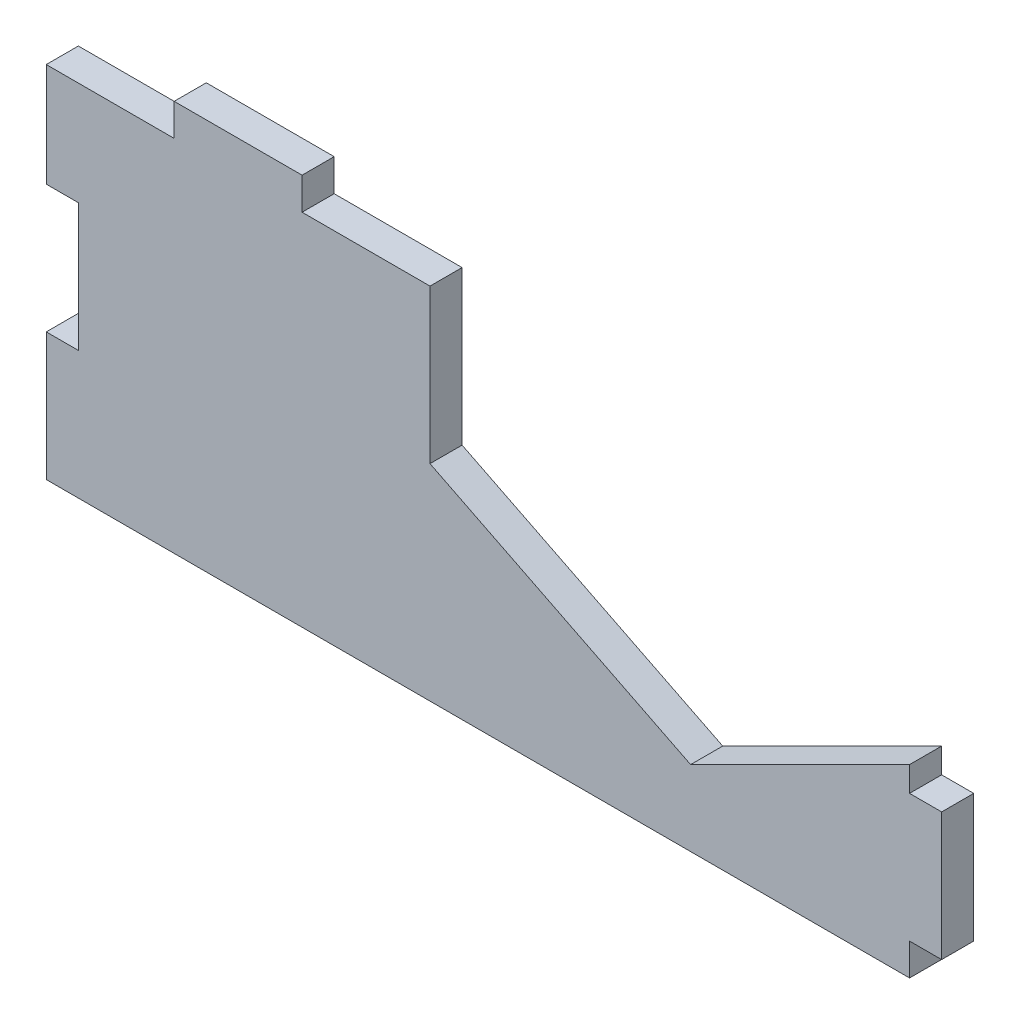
SolidWorks part; units mm, degrees
ref_plane "Front Plane" through (0, 0, 0) normal (0, 0, 1) x (1, 0, 0)
ref_plane "Top Plane" through (0, 0, 0) normal (0, 1, 0) x (1, 0, 0)
ref_plane "Right Plane" through (0, 0, 0) normal (1, 0, 0) x (0, 0, -1)
sketch "Sketch1" plane through (0, 0, 0) normal (0, 0, 1) x (1, 0, 0)
  line L0 (-209.4741, 246.21) -> (-363.745, 323.3454) construction
  line L1 (-79.8865, 311.0038) -> (-209.4741, 246.21) construction
  line L11 (-590.8865, 277.3229) -> (-590.8865, 201.6091)
  line L13 (-79.8865, 296.251) -> (-60.8865, 296.251)
  line L20 (-79.8865, 220.5372) -> (-60.8865, 220.5372)
  line L24 (-590.8865, 414.3653) -> (-515.1727, 414.3653)
  line L30 (-79.8865, 311.0038) -> (-79.8865, 296.251)
  line L32 (-590.8865, 277.3229) -> (-571.8865, 277.3229)
  line L35 (-515.1727, 433.3653) -> (-515.1727, 414.3653)
  line L37 (-590.8865, 353.0367) -> (-571.8865, 353.0367)
  line L38 (-79.8865, 220.5372) -> (-79.8865, 201.6091)
  line L39 (-60.8865, 296.251) -> (-60.8865, 220.5372)
  line L40 (-571.8865, 353.0367) -> (-571.8865, 277.3229)
  line L41 (-590.8865, 414.3653) -> (-590.8865, 353.0367)
  line L42 (-515.1727, 433.3653) -> (-439.4588, 433.3653)
  line L43 (-363.745, 323.3454) -> (-209.4741, 246.21)
  line L44 (-439.4588, 414.3653) -> (-363.745, 414.3653)
  line L45 (-363.745, 414.3653) -> (-363.745, 323.3454)
  line L46 (-439.4588, 433.3653) -> (-439.4588, 414.3653)
  line L47 (-590.8865, 201.6091) -> (-79.8865, 201.6091)
  line L48 (-209.4741, 246.21) -> (-79.8865, 311.0038)
  point P1 (-363.745, 323.3454)
  point P2 (-209.4741, 246.21)
  point P7 (-79.8865, 311.0038)
  dimension "D1" = 19
  dimension "D3" = 530
extrude "Boss-Extrude1" add sketch "Sketch1" along normal blind 19
